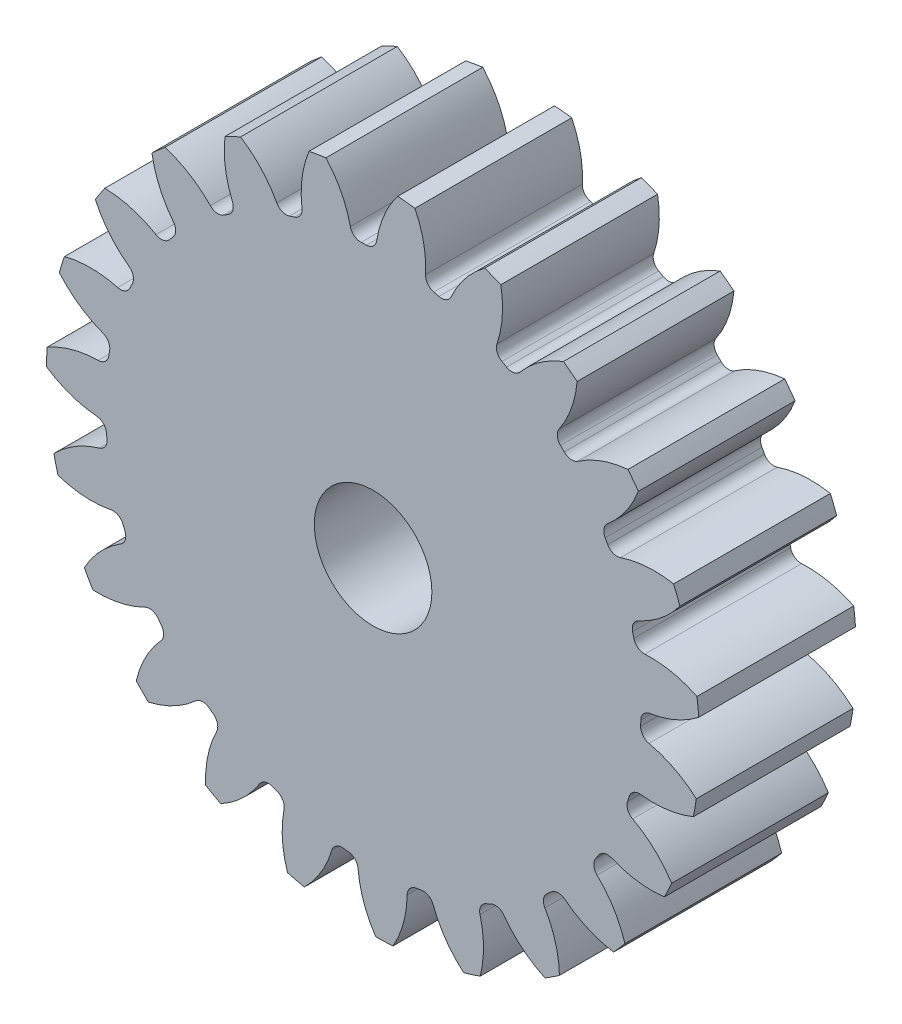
SolidWorks part; units mm, degrees
ref_plane "Front" through (0, 0, 0) normal (0, 0, 1) x (1, 0, 0)
ref_plane "Top" through (0, 0, 0) normal (0, 1, 0) x (1, 0, 0)
ref_plane "Right" through (0, 0, 0) normal (1, 0, 0) x (0, 0, -1)
sketch "Sketch3" plane through (0, 0, 0) normal (0, 0, 1) x (1, 0, 0)
  circle A0 centre (0, 0) radius 211.6667
  dimension "od" = 423.3333
extrude "gearBody" add sketch "Sketch3" along normal blind 101.6
sketch "Sketch2" plane through (0, 0, 0) normal (0, 0, 1) x (1, 0, 0)
  line L0 (0, 0) -> (169.0602, 70.027) construction
  line L1 (210.0613, -30.8864) -> (0, 0) construction
  line L2 (0, 0) -> (36.3143, 0) construction
  line L3 (194.6185, 6.6865) -> (193.7238, -19.8031) construction
  line L5 (194.1711, -6.5583) -> (0, 0) construction
  line L7 (0, 0) -> (182.9895, 0) construction
  arc A0 (182.9623, 3.1541) -> (182.3325, -15.4923) centre (0, 0) ccw construction
  arc A1 (211.0493, 16.1552) -> (209.4782, -30.3589) centre (0, 0) ccw construction
  arc A2 (194.6185, 6.6865) -> (193.7238, -19.8031) centre (0, 0) ccw construction
  arc A3 (173.4013, -7.5755) -> (173.5172, -4.142) centre (0, 0) ccw
  arc A4 (210.0613, -30.8864) -> (178.7892, -14.6036) centre (163.9499, -81.2748) ccw
  arc A5 (210.0613, -30.8864) -> (211.6667, 16.6422) centre (0, 0) ccw
  arc A6 (211.6667, 16.6422) -> (179.3672, 2.5065) centre (169.0602, 70.027) cw
  arc A7 (173.5172, -4.142) -> (179.3672, 2.5065) centre (180.4071, -4.3064) cw
  arc A8 (178.7892, -14.6036) -> (173.4013, -7.5755) centre (180.2866, -7.8763) cw
  point P6 (211.6667, 16.6422)
  point P22 (210.0613, -30.8864)
  dimension "baseDia" = 365.979
  dimension "od" = 423.3333
  dimension "pd" = 389.4667
  dimension "rd" = 347.1333
  dimension "rFillet" = 6.8919
  dimension "pointX" = 211.6667
  dimension "pointY" = 16.6422
  dimension "CTT" = 26.4896
  dimension "flankCenterAngle" = 22.5
extrude "toothCut" cut sketch "Sketch2" along normal through all
pattern_circular "CirPattern1" count 23 over 360 about axis through (0, 0, 0) along (0, 0, 1) of "toothCut"
sketch "hub1Dia" plane through (0, 0, 0) normal (0, 0, -1) x (-1, 0, 0)
  circle A0 centre (0, 0) radius 12.7
  dimension "hub1Dia" = 25.4
sketch "hub2Dia" plane through (0, 0, 101.6) normal (0, 0, 1) x (1, 0, 0)
  circle A0 centre (0, 0) radius 12.7
  dimension "hub2dia" = 25.4
sketch "boreDia" plane through (0, 0, 0) normal (0, 0, 1) x (1, 0, 0)
  circle A0 centre (0, 0) radius 38.1
  dimension "boreDia" = 76.2
extrude "bore" cut sketch "boreDia" against normal mid plane 25400
